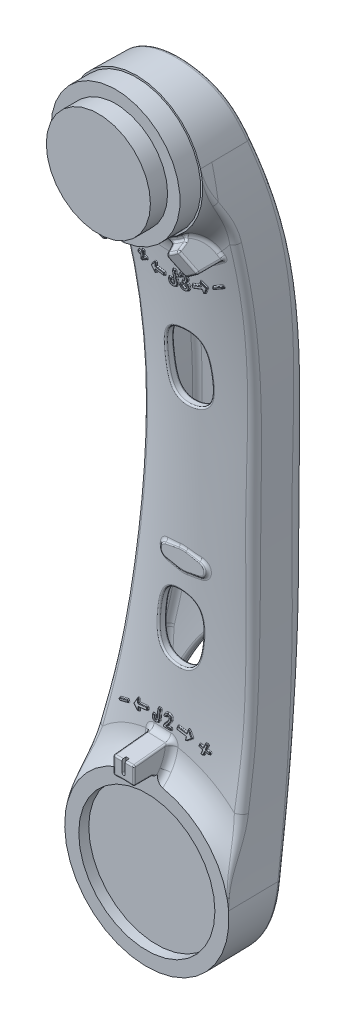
SolidWorks part; units mm, degrees
ref_plane "前视基准面" through (0, 0, 0) normal (0, 0, 1) x (1, 0, 0)
ref_plane "上视基准面" through (0, 0, 0) normal (0, 1, 0) x (1, 0, 0)
ref_plane "右视基准面" through (0, 0, 0) normal (1, 0, 0) x (0, 0, -1)
imported_body "输入1"
sketch "草图2" plane through (0, 0, -55.5) normal (0, 0, -1) x (-1, 0, 0)
  circle A0 centre (0, 785) radius 14
  dimension "D1" = 28
extrude "切除-拉伸1" cut sketch "草图2" against normal blind 7
chamfer "倒角1" distance 1 angle 45 1 edges at (-14, 785, -55.5)
